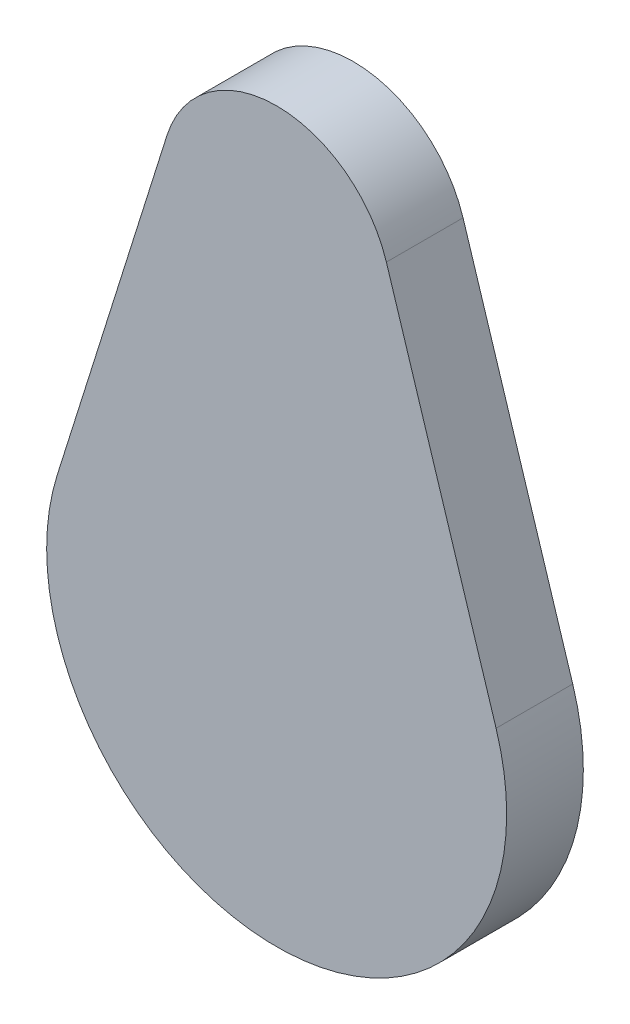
SolidWorks part; units mm, degrees
ref_plane "正面" through (0, 0, 0) normal (0, 0, 1) x (1, 0, 0)
ref_plane "平面" through (0, 0, 0) normal (0, 1, 0) x (1, 0, 0)
ref_plane "右側面" through (0, 0, 0) normal (1, 0, 0) x (0, 0, -1)
sketch "layout" plane through (0, 0, 0) normal (0, 0, 1) x (1, 0, 0)
  line L0 (0, 0) -> (0, 50) construction
  circle A0 centre (0, 0) radius 30
  circle A1 centre (0, 50) radius 15
  dimension "D2" = 30
  dimension "D3" = 60
  dimension "D1" = 50
sketch "ｽｹｯﾁ2" plane through (0, 0, 0) normal (0, 0, 1) x (1, 0, 0)
  line L0 (-14.3091, 54.5) -> (-28.6182, 9)
  line L1 (14.3091, 54.5) -> (28.6182, 9)
  circle A0 centre (0, 50) radius 15 construction
  circle A1 centre (0, 0) radius 30 construction
  arc A2 (-28.6182, 9) -> (28.6182, 9) centre (0, 0) ccw
  arc A3 (14.3091, 54.5) -> (-14.3091, 54.5) centre (0, 50) ccw
extrude "押し出し1" add sketch "ｽｹｯﾁ2" along normal blind 10
